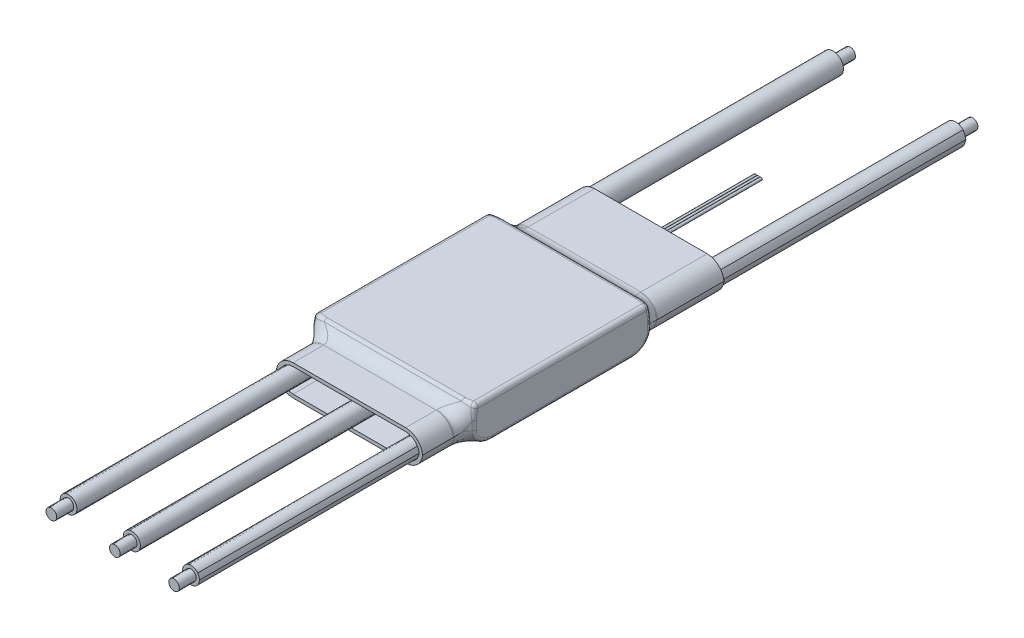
SolidWorks part; units mm, degrees
ref_plane "Front Plane" through (0, 0, 0) normal (0, 0, 1) x (1, 0, 0)
ref_plane "Top Plane" through (0, 0, 0) normal (0, 1, 0) x (1, 0, 0)
ref_plane "Right Plane" through (0, 0, 0) normal (1, 0, 0) x (0, 0, -1)
sketch "Sketch2" plane through (0, 0, 0) normal (0, 1, 0) x (1, 0, 0)
  line L1 (-24.7983, 10.4699) -> (-0.7953, 10.4699)
  line L2 (-24.7983, 10.4699) -> (-24.7983, -34.4881)
  line L3 (-24.7983, -34.4881) -> (-0.7953, -34.4881)
  line L4 (-0.7953, 10.4699) -> (-0.7953, -34.4881)
extrude "Boss-Extrude2" add sketch "Sketch2" along normal blind 5.842
sketch "Sketch3" plane through (0, 5.842, 0) normal (0, 1, 0) x (1, 0, 0)
  line L0 (-0.7953, -34.4881) -> (-0.7953, 10.4699) construction
  line L1 (-0.7953, -1.6029) -> (-24.7983, -1.6029)
  line L2 (-0.7953, -1.6029) -> (-0.7953, -27.7406)
  line L3 (-0.7953, -27.7406) -> (-24.7983, -27.7406)
  line L4 (-24.7983, -1.6029) -> (-24.7983, -27.7406)
  line L5 (-24.7983, 10.4699) -> (-24.7983, -34.4881) construction
  line L6 (-0.7953, 10.4699) -> (-24.7983, 10.4699) construction
  line L7 (-1.754, 10.4699) -> (-23.6351, 10.4699)
  line L8 (-1.754, 10.4699) -> (-1.754, -34.4881)
  line L9 (-1.754, -34.4881) -> (-23.6351, -34.4881)
  line L10 (-23.6351, 10.4699) -> (-23.6351, -34.4881)
  line L11 (-24.7983, -34.4881) -> (-0.7953, -34.4881) construction
  line L13 (-23.6351, 10.4699) -> (-24.7983, 10.4699)
  line L14 (-23.6351, 10.4699) -> (-23.6351, -1.6029)
  line L15 (-23.6351, -1.6029) -> (-24.7983, -1.6029)
  line L16 (-24.7983, 10.4699) -> (-24.7983, -1.6029)
  line L17 (-0.7953, 10.4699) -> (-1.754, 10.4699)
  line L18 (-0.7953, 10.4699) -> (-0.7953, -1.6029)
  line L19 (-0.7953, -1.6029) -> (-1.754, -1.6029)
  line L20 (-1.754, 10.4699) -> (-1.754, -1.6029)
  line L21 (-0.7953, -34.4881) -> (-1.754, -34.4881)
  line L22 (-0.7953, -34.4881) -> (-0.7953, -27.7406)
  line L23 (-0.7953, -27.7406) -> (-1.754, -27.7406)
  line L24 (-1.754, -34.4881) -> (-1.754, -27.7406)
  line L25 (-24.7983, -27.7406) -> (-23.6351, -27.7406)
  line L26 (-24.7983, -27.7406) -> (-24.7983, -34.4881)
  line L27 (-24.7983, -34.4881) -> (-23.6351, -34.4881)
  line L28 (-23.6351, -27.7406) -> (-23.6351, -34.4881)
  line L29 (-1.754, -27.7406) -> (-23.6351, -27.7406)
  line L30 (-1.754, -27.7406) -> (-1.754, -34.4881)
  line L31 (-1.754, -34.4881) -> (-23.6351, -34.4881)
  line L32 (-23.6351, -27.7406) -> (-23.6351, -34.4881)
  line L33 (-1.754, -1.6029) -> (-23.6351, -1.6029)
  line L34 (-1.754, -1.6029) -> (-1.754, 10.4699)
  line L35 (-1.754, 10.4699) -> (-23.6351, 10.4699)
  line L36 (-23.6351, -1.6029) -> (-23.6351, 10.4699)
extrude "Cut-Extrude1" cut sketch "Sketch3" against normal blind 5.842 contours L8 L1 M4 M3 | L10 L1 M4 M1 | L10 L3 M1 M2 | L3 L8 M2 M3
sketch "Sketch5" plane through (0, 5.842, 0) normal (0, 1, 0) x (1, 0, 0)
  line L0 (-23.6351, -27.7406) -> (-23.6351, -34.4881) construction
  line L1 (-1.754, 10.4699) -> (-23.6351, 10.4699)
  line L2 (-1.754, 10.4699) -> (-1.754, -1.6029)
  line L3 (-1.754, -1.6029) -> (-23.6351, -1.6029)
  line L4 (-23.6351, 10.4699) -> (-23.6351, -1.6029)
  line L5 (-1.754, -34.4881) -> (-23.6351, -34.4881)
  line L6 (-1.754, -34.4881) -> (-1.754, -27.7406)
  line L7 (-1.754, -27.7406) -> (-23.6351, -27.7406)
  line L8 (-23.6351, -34.4881) -> (-23.6351, -27.7406)
extrude "Cut-Extrude2" cut sketch "Sketch5" against normal blind 1.27
fillet "Fillet2" radius 2.54 6 edges at (-1.754, 2.286, 27.7406) (-12.6946, 4.572, 27.7406) (-23.6351, 2.286, 27.7406) (-1.754, 2.286, 1.6029) (-12.6946, 4.572, 1.6029) (-23.6351, 2.286, 1.6029)
fillet "Fillet3" radius 2.54 20 edges at (-23.9448, 0, 28.6596) (-23.9625, 4.9374, 28.6277) (-23.6351, 4.5722, 29.9076) (-1.5018, 0, 28.6249) (-1.4904, 4.9535, 28.6015) (-1.754, 4.5742, 29.8342) (-1.5018, 0, 0.7186) (-1.6636, 4.7306, 0.2868) (-1.754, 4.5742, -0.4908) (-23.9448, 0, 0.6838) (-23.7691, 4.7291, 0.2825) (-23.6351, 4.5722, -0.5642) (-23.6351, 0, 32.1816) (-23.6351, 4.572, 32.2142) (-1.754, 0, 32.1082) (-1.754, 4.572, 32.2142) (-1.754, 0, -5.4274) (-1.754, 4.572, -5.5334) (-23.6351, 0, -5.5007) (-23.6351, 4.572, -5.5334)
fillet "Fillet5" radius 0.635 22 edges at (-0.7953, 3.388, 1.6029) (-0.7953, 0.6405, 2.618) (-0.7953, 0, 14.6717) (-0.7953, 1.1493, 27.2325) (-0.7953, 3.388, 27.7406) (-12.8077, 5.842, 1.6029) (-0.7953, 5.842, 14.6717) (-12.8077, 5.842, 27.7406) (-24.7983, 1.0987, 2.1209) (-24.7983, 3.5011, 1.6029) (-24.7983, 5.842, 14.6717) (-24.7983, 3.5011, 27.7406) (-24.7983, 0.6184, 26.7456) (-24.7983, 0, 14.6717)
shell "Shell1" thickness 2.54
sketch "Sketch8" plane through (0, 0, -10.4699) normal (0, 0, -1) x (-1, 0, 0)
  line L4 (4.294, 0.254) -> (21.0951, 0.254)
  line L5 (21.0951, 4.318) -> (4.294, 4.318)
  line L6 (4.294, 0.254) -> (21.0951, 0.254)
  line L7 (21.0951, 4.318) -> (4.294, 4.318)
  arc A8 (4.294, 4.318) -> (2.0222, 2.286) centre (4.294, 2.032) ccw
  arc A9 (2.0222, 2.286) -> (4.294, 0.254) centre (4.294, 2.54) ccw
  arc A10 (21.0951, 0.254) -> (23.367, 2.286) centre (21.0951, 2.54) ccw
  arc A11 (23.367, 2.286) -> (21.0951, 4.318) centre (21.0951, 2.032) ccw
  arc A12 (4.294, 4.318) -> (2.0222, 2.286) centre (4.294, 2.032) ccw
  arc A13 (2.0222, 2.286) -> (4.294, 0.254) centre (4.294, 2.54) ccw
  arc A14 (21.0951, 0.254) -> (23.367, 2.286) centre (21.0951, 2.54) ccw
  arc A15 (23.367, 2.286) -> (21.0951, 4.318) centre (21.0951, 2.032) ccw
  point P0 (0, 0)
  dimension "D1" = 0.254
extrude "Cut-Extrude5" cut sketch "Sketch8" against normal blind 9.398
sketch "Sketch9" plane through (0, 0, 34.4881) normal (0, 0, 1) x (1, 0, 0)
  line L4 (-21.0951, 0.508) -> (-4.294, 0.508)
  line L5 (-4.294, 4.064) -> (-21.0951, 4.064)
  line L6 (-21.0951, 0.508) -> (-4.294, 0.508)
  line L7 (-4.294, 4.064) -> (-21.0951, 4.064)
  arc A8 (-21.0951, 4.064) -> (-23.1112, 2.286) centre (-21.0951, 2.032) ccw
  arc A9 (-23.1112, 2.286) -> (-21.0951, 0.508) centre (-21.0951, 2.54) ccw
  arc A10 (-4.294, 0.508) -> (-2.278, 2.286) centre (-4.294, 2.54) ccw
  arc A11 (-2.278, 2.286) -> (-4.294, 4.064) centre (-4.294, 2.032) ccw
  arc A12 (-21.0951, 4.064) -> (-23.1112, 2.286) centre (-21.0951, 2.032) ccw
  arc A13 (-23.1112, 2.286) -> (-21.0951, 0.508) centre (-21.0951, 2.54) ccw
  arc A14 (-4.294, 0.508) -> (-2.278, 2.286) centre (-4.294, 2.54) ccw
  arc A15 (-2.278, 2.286) -> (-4.294, 4.064) centre (-4.294, 2.032) ccw
  dimension "D1" = 0.508
extrude "Cut-Extrude7" cut sketch "Sketch9" against normal blind 5.334
sketch "Sketch10" plane through (0, 0, -1.0719) normal (0, 0, -1) x (-1, 0, 0)
  line L0 (2.0222, 2.286) -> (3.5462, 2.286)
  line L1 (23.367, 2.286) -> (21.8223, 2.4067)
  circle A0 centre (3.5462, 2.286) radius 1.5443
  circle A1 centre (21.8223, 2.4067) radius 1.5494
extrude "Boss-Extrude4" add sketch "Sketch10" along normal blind 45.72
sketch "Sketch12" plane through (0, 0, -1.0719) normal (0, 0, -1) x (-1, 0, 0)
  line L0 (23.367, 2.286) -> (21.8176, 2.286)
  circle A0 centre (21.8176, 2.286) radius 1.5494
extrude "Boss-Extrude6" add sketch "Sketch12" along normal blind 45.72
sketch "Sketch13" plane through (0, 0, 29.1541) normal (0, 0, 1) x (1, 0, 0)
  line L0 (-23.1112, 2.286) -> (-21.8412, 2.286)
  line L1 (-2.278, 2.286) -> (-3.548, 2.286)
  circle A0 centre (-3.548, 2.286) radius 1.27
  circle A1 centre (-21.8412, 2.286) radius 1.27
  circle A2 centre (-12.3837, 2.286) radius 1.27
extrude "Boss-Extrude7" add sketch "Sketch13" along normal blind 38.1
sketch "Sketch14" plane through (0, 0, -1.0719) normal (0, 0, -1) x (-1, 0, 0)
  line L0 (5.0905, 2.286) -> (20.2682, 2.286)
  arc A0 (2.4244, 1.2246) -> (2.4244, 3.3474) centre (3.5462, 2.286) ccw construction
  arc A1 (23.026, 3.2556) -> (23.026, 1.3164) centre (21.8176, 2.286) ccw construction
  circle A2 centre (12.6793, 2.286) radius 0.2032
extrude "Boss-Extrude8" add sketch "Sketch14" along normal blind 25.4 contours L0 A2 | L0 A2
sketch "Sketch15" plane through (0, 0, -1.0719) normal (0, 0, -1) x (-1, 0, 0)
  line L0 (12.8825, 2.286) -> (13.0883, 2.286)
  circle A0 centre (12.6793, 2.286) radius 0.2032 construction
  circle A1 centre (13.0883, 2.286) radius 0.2032
extrude "Boss-Extrude11" add sketch "Sketch15" along normal blind 25.4
sketch "Sketch17" plane through (0, 0, -1.0719) normal (0, 0, -1) x (-1, 0, 0)
  line L0 (12.4761, 2.286) -> (12.2704, 2.286)
  circle A0 centre (12.6793, 2.286) radius 0.2032 construction
  circle A1 centre (12.2704, 2.286) radius 0.2032
extrude "Boss-Extrude12" add sketch "Sketch17" along normal blind 25.4
sketch "Sketch18" plane through (0, 0, -46.7919) normal (0, 0, -1) x (-1, 0, 0)
  circle A0 centre (3.5462, 2.286) radius 0.7988
  circle A1 centre (21.8176, 2.286) radius 0.7994
extrude "Boss-Extrude13" add sketch "Sketch18" along normal blind 2.54
sketch "Sketch19" plane through (0, 0, 67.2541) normal (0, 0, 1) x (1, 0, 0)
  circle A0 centre (-21.8412, 2.286) radius 0.8014
  circle A1 centre (-12.3837, 2.286) radius 0.7902
  circle A2 centre (-3.548, 2.286) radius 0.7879
extrude "Boss-Extrude14" add sketch "Sketch19" along normal blind 2.54
